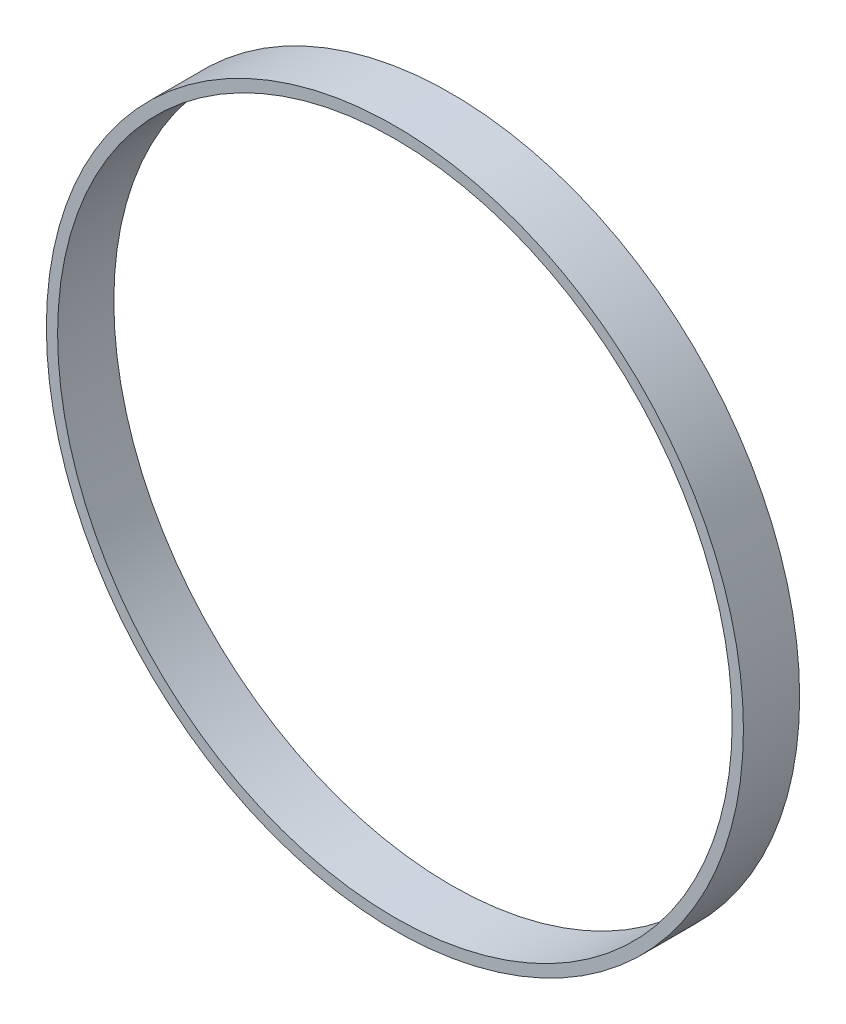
SolidWorks part; units mm, degrees
ref_plane "Plan de face" through (0, 0, 0) normal (0, 0, 1) x (1, 0, 0)
ref_plane "Plan de dessus" through (0, 0, 0) normal (0, 1, 0) x (1, 0, 0)
ref_plane "Plan de droite" through (0, 0, 0) normal (1, 0, 0) x (0, 0, -1)
sketch "Esquisse1" plane through (0, 0, 0) normal (0, 0, 1) x (1, 0, 0)
  circle A0 centre (0, 0) radius 30
  circle A1 centre (0, 0) radius 31
  dimension "D1" = 60
  dimension "D2" = 62
extrude "Extrusion1" add sketch "Esquisse1" along normal blind 5
